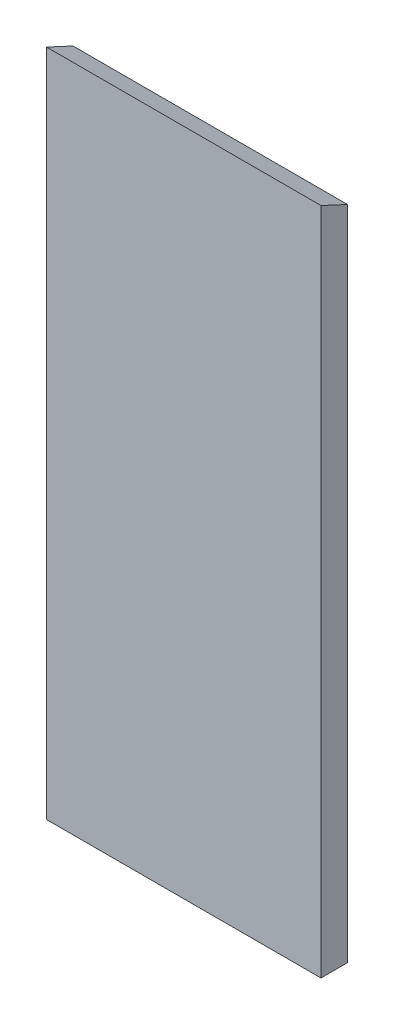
SolidWorks part; units mm, degrees
ref_plane "Plan de face" through (0, 0, 0) normal (0, 0, 1) x (1, 0, 0)
ref_plane "Plan de dessus" through (0, 0, 0) normal (0, 1, 0) x (1, 0, 0)
ref_plane "Plan de droite" through (0, 0, 0) normal (1, 0, 0) x (0, 0, -1)
sketch "Esquisse1" plane through (0, 0, 0) normal (1, 0, 0) x (0, 0, -1)
  line L0 (12, 296.6) -> (0, 296.6) construction
  line L1 (0, 0) -> (12, 0)
  line L2 (0, 0) -> (0, 302.1957)
  line L3 (0, 302.1957) -> (12, 296.6)
  line L4 (12, 0) -> (12, 296.6)
  dimension "D1" = 296.6
  dimension "D2" = 12
  dimension "D3" = 25
extrude "Boss.-Extru.1" add sketch "Esquisse1" along normal blind 124 contours L4 L3 L2 L1
